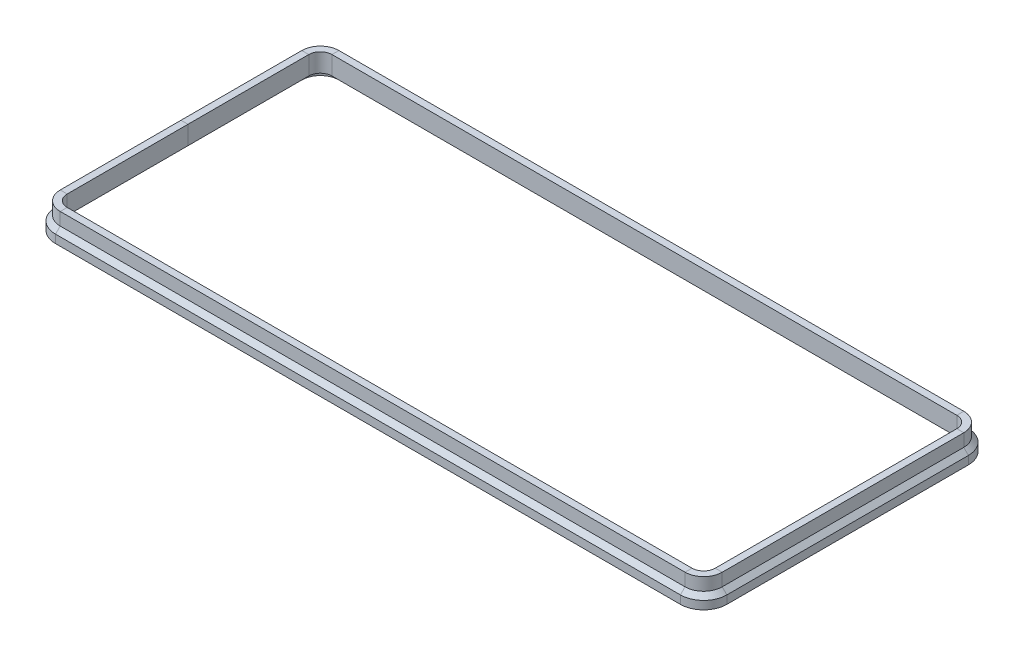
SolidWorks part; units mm, degrees
ref_plane "Front Plane" through (0, 0, 0) normal (0, 0, 1) x (1, 0, 0)
ref_plane "Top Plane" through (0, 0, 0) normal (0, 1, 0) x (1, 0, 0)
ref_plane "Right Plane" through (0, 0, 0) normal (1, 0, 0) x (0, 0, -1)
sketch "Esquisse1" plane through (0, 0, 0) normal (0, 1, 0) x (1, 0, 0)
  line L1 (-134.5, 60) -> (134.5, 60)
  line L2 (-142.5, 52) -> (-142.5, -52)
  line L3 (-134.5, -60) -> (134.5, -60)
  line L4 (142.5, 52) -> (142.5, -52)
  arc A1 (134.5, 60) -> (142.5, 52) centre (134.5, 52) cw
  arc A2 (142.5, -52) -> (134.5, -60) centre (134.5, -52) cw
  arc A3 (-134.5, -60) -> (-142.5, -52) centre (-134.5, -52) cw
  arc A4 (-142.5, 52) -> (-134.5, 60) centre (-134.5, 52) cw
  point P1 (0, 60)
  point P2 (-142.5, 0)
  dimension "D2" = 8
  dimension "D4" = 285
  dimension "D5" = 120
sketch "Esquisse2" plane through (0, 0, 0) normal (0, 0, 1) x (1, 0, 0)
  line L0 (-142.5, 0) -> (-139.5, 0)
  line L1 (-134.5, 0) -> (-142.5, 0) construction
  line L2 (-142.5, 2.539) -> (-144.5, 0.539)
  line L3 (-139.5, 0) -> (-139.5, 8)
  line L4 (-139.5, 8) -> (-142.5, 8)
  line L5 (-142.5, 8) -> (-142.5, 2.539)
  line L7 (-144.5, 0.539) -> (-144.5, -3)
  line L8 (-144.5, -3) -> (-142.5, -3)
  line L9 (-142.5, -3) -> (-142.5, 0)
  point P2 (-144.5, 0.479)
  point P3 (-144.5, 0.539)
  point P4 (-142.5, 2.6842)
  dimension "D1" = 8
  dimension "D2" = 3
  dimension "D3" = 2
  dimension "D4" = 3
  dimension "D5" = 45
sweep "Balayage1" add profiles "Esquisse2" path "Esquisse1"
